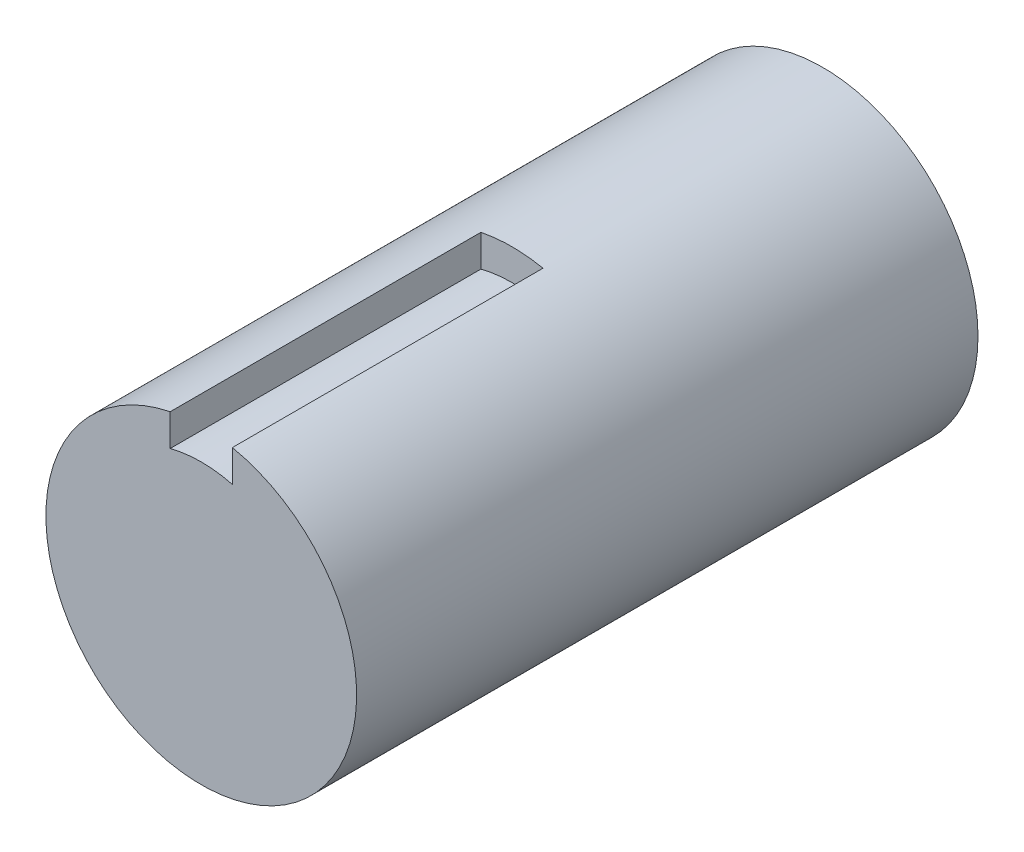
SolidWorks part; units mm, degrees
ref_plane "Płaszczyzna przednia" through (0, 0, 0) normal (0, 0, 1) x (1, 0, 0)
ref_plane "Płaszczyzna górna" through (0, 0, 0) normal (0, 1, 0) x (1, 0, 0)
ref_plane "Płaszczyzna prawa" through (0, 0, 0) normal (1, 0, 0) x (0, 0, -1)
sketch "Szkic1" plane through (0, 0, 0) normal (0, 0, 1) x (1, 0, 0)
  circle A0 centre (0, 0) radius 50
  dimension "Średnica wałka" = 100
extrude "Dodanie-wyciągnięcie1" add sketch "Szkic1" along normal blind 200
sketch "Szkic2" plane through (0, 0, 200) normal (0, 0, 1) x (1, 0, 0)
  line L0 (-10, 48.9898) -> (-10, 38.7298)
  line L1 (10, 48.9898) -> (10, 38.7298)
  arc A0 (10, 48.9898) -> (-10, 48.9898) centre (0, 0) ccw
  circle A1 centre (0, 0) radius 50 construction
  arc A2 (10, 38.7298) -> (-10, 38.7298) centre (0, 0) ccw
  dimension "Średnica dna rowka" = 80
  dimension "Szerokość rowka" = 20
extrude "Wycięcie rowka" cut sketch "Szkic2" against normal blind 100
